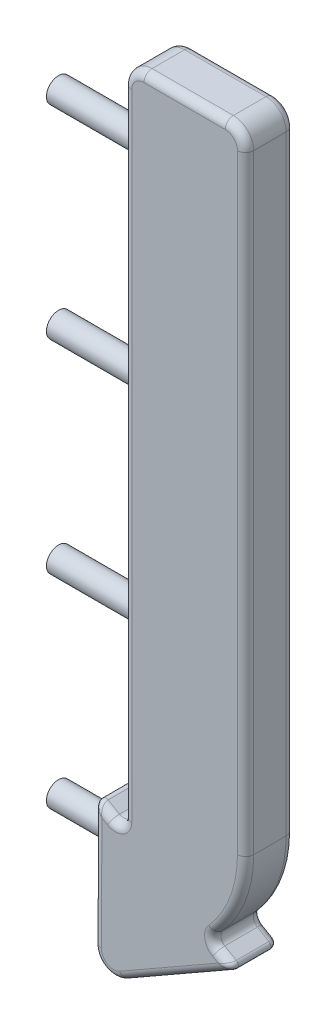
SolidWorks part; units mm, degrees
ref_plane "Front Plane" through (0, 0, 0) normal (0, 0, 1) x (1, 0, 0)
ref_plane "Top Plane" through (0, 0, 0) normal (0, 1, 0) x (1, 0, 0)
ref_plane "Right Plane" through (0, 0, 0) normal (1, 0, 0) x (0, 0, -1)
imported_body "Stock-V1-1"
imported_body "Stock-V1-2"
imported_body "Stock-V1-3"
imported_body "Stock-V1-4"
imported_body "Stock-V1-5"
move or copy body "Body-Move/Copy1" bodies to move or copy 102 103 104 105 101 copy no rotation origin (-154.4537, 0, 135) rotation axis (0, 1, 0) rotation angle 180
other "Move Face1" parameters "D1"=1
